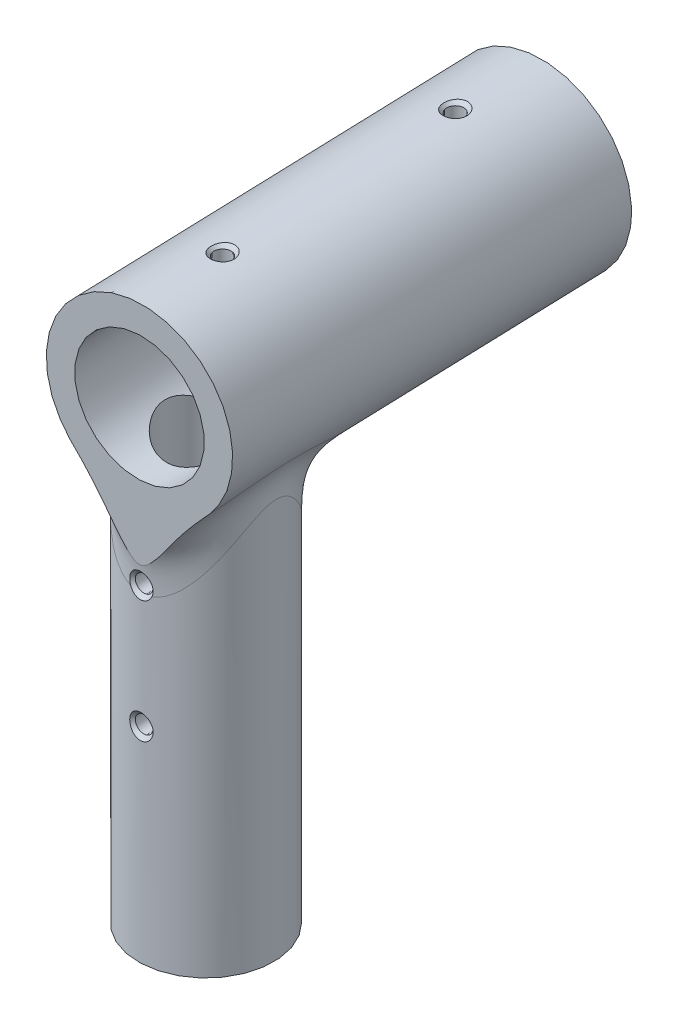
SolidWorks part; units mm, degrees
other "inverted_pendulum_nx_objects[1]"
ref_plane "Front Plane" through (0, 0, 0) normal (0, 0, 1) x (1, 0, 0)
ref_plane "Top Plane" through (0, 0, 0) normal (0, 1, 0) x (1, 0, 0)
ref_plane "Right Plane" through (0, 0, 0) normal (1, 0, 0) x (0, 0, -1)
imported_body "new-rod-holder.stp<1>"
move or copy body "Body-Move/Copy1" bodies to move or copy 101 placed by mates yes parameters "D1"=0, "D2"=0, "D3"=0
move or copy body "Body-Move/Copy2" bodies to move or copy 102 placed by mates yes parameters "D1"=0, "D2"=0, "D3"=0
